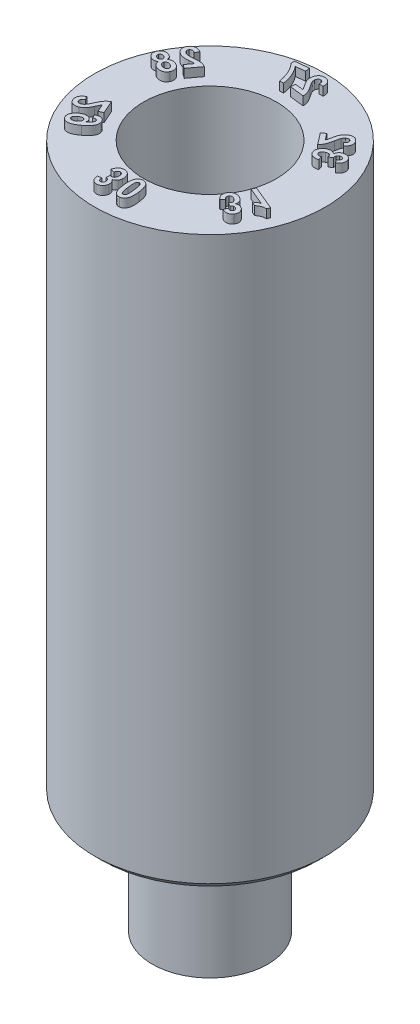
SolidWorks part; units mm, degrees
other "<M4L10-SetScrew>-<Chamfer1>" parameters "D10"=0.24
ref_plane "Front Plane" through (0, 0, 0) normal (0, 0, 1) x (1, 0, 0)
ref_plane "Top Plane" through (0, 0, 0) normal (0, 1, 0) x (1, 0, 0)
ref_plane "Right Plane" through (0, 0, 0) normal (1, 0, 0) x (0, 0, -1)
sketch "Sketch1" plane through (0, 0, 0) normal (0, 0, 1) x (1, 0, 0)
  line L0 (0, 0) -> (0, 20) construction
  line L1 (0, -4.4) -> (0, 4.4) construction
  line L2 (2, -19.7) -> (3.76, -19.7)
  line L4 (4, -19.46) -> (4, 0)
  line L5 (4, 0) -> (2.3, 0)
  line L6 (2.3, 0) -> (2.3, -4)
  line L7 (2.3, -4) -> (1.25, -4)
  line L8 (1.25, -4) -> (1.25, -13.7)
  line L9 (1.25, -13.7) -> (2, -13.7)
  line L10 (2, -13.7) -> (2, -19.7)
  line L11 (3.76, -19.7) -> (4, -19.46)
  point P6 (4, -19.7)
  dimension "D1" = 4
  dimension "D2" = 6
  dimension "D3" = 2.5
  dimension "D4" = 4.6
  dimension "D5" = 8
  dimension "D6" = 4
  dimension "D7" = 19.7
revolve "Revolve1" add sketch "Sketch1" angle 360 about L0
sketch "Sketch2" plane through (0, 0, 0) normal (0, 1, 0) x (1, 0, 0)
  line L0 (0, 0) -> (0, 4.1718) construction
  line L1 (0, 0) -> (3.6129, 2.0859) construction
  line L2 (0, 0) -> (3.6129, -2.0859) construction
  line L3 (0, 0) -> (0, -4.1718) construction
  line L4 (0, 0) -> (-3.6129, -2.0859) construction
  line L5 (0, 0) -> (-3.6129, 2.0859) construction
  arc A0 (0.6033, 2.6369) -> (1.8276, 1.9942) centre (0, 0) ccw construction
  text T0 "27     28     29     30     31     32" font "Arial Narrow" height 0.9
  point P12 (0, 0)
  point P16 (0, 0)
  point P17 (0, 0)
  point P20 (0, 0)
  dimension "D1" = 5.41
  dimension "D2" = 6
extrude "Boss-Extrude1" add sketch "Sketch2" along normal blind 0.3
inserted part "M4L10-SetScrew"
move or copy body "Body-Move/Copy2" placed by mates yes
other "Distance1" parameters "D1"=4
